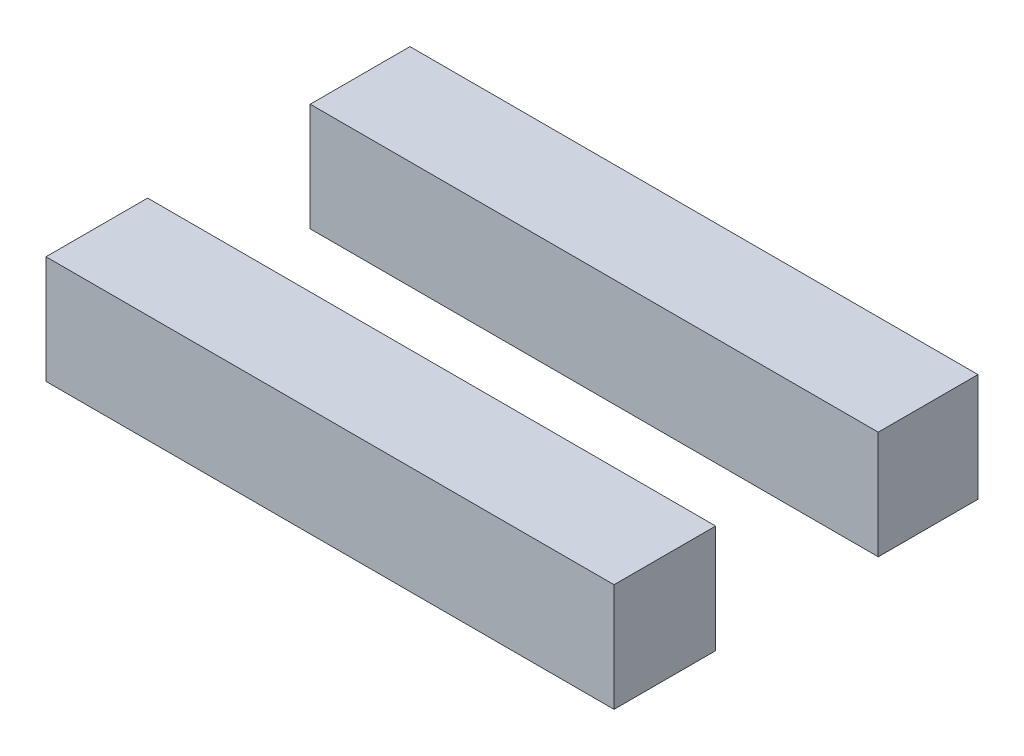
SolidWorks part; units mm, degrees
ref_plane "Front Plane" through (0, 0, 0) normal (0, 0, 1) x (1, 0, 0)
ref_plane "Top Plane" through (0, 0, 0) normal (0, 1, 0) x (1, 0, 0)
ref_plane "Right Plane" through (0, 0, 0) normal (1, 0, 0) x (0, 0, -1)
sketch "Sketch1" plane through (0, 0, 0) normal (0, 1, 0) x (1, 0, 0)
  line L0 (86.7956, -55.6147) -> (-86.7956, 55.6147) construction
  line L1 (-86.7956, 55.6147) -> (86.7956, 55.6147)
  line L2 (-86.7956, 55.6147) -> (-86.7956, -55.6147)
  line L3 (-86.7956, -55.6147) -> (86.7956, -55.6147)
  line L4 (86.7956, 55.6147) -> (86.7956, -55.6147)
extrude "Extrude1" add sketch "Sketch1" along normal blind 33
sketch "Sketch3" plane through (0, 33, 0) normal (0, 1, 0) x (-1, 0, 0)
  line L1 (-95.3793, -25.1299) -> (94.237, -25.1299)
  line L2 (-95.3793, -25.1299) -> (-95.3793, 24.5587)
  line L3 (-95.3793, 24.5587) -> (94.237, 24.5587)
  line L4 (94.237, -25.1299) -> (94.237, 24.5587)
extrude "Cut-Extrude1" cut sketch "Sketch3" against normal through all
